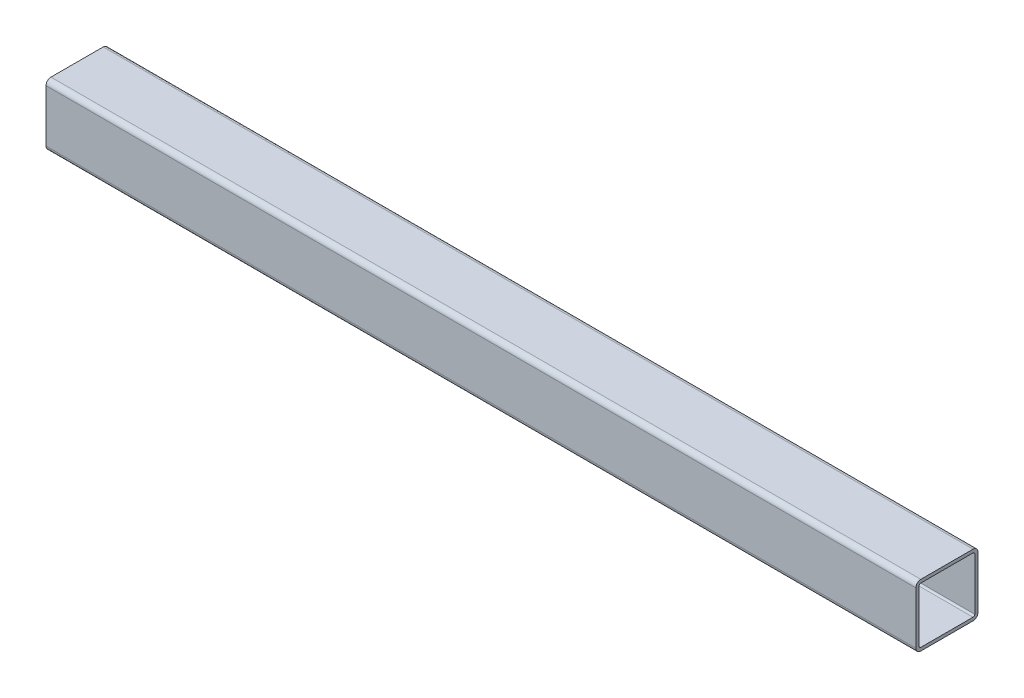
SolidWorks part; units mm, degrees
ref_plane "Front Plane" through (0, 0, 0) normal (0, 0, 1) x (1, 0, 0)
ref_plane "Top Plane" through (0, 0, 0) normal (0, 1, 0) x (1, 0, 0)
ref_plane "Right Plane" through (0, 0, 0) normal (1, 0, 0) x (0, 0, -1)
sketch "Sketch1" plane through (0, 0, 0) normal (1, 0, 0) x (0, 0, -1)
  line L0 (0, 2.54) -> (0, 29.21)
  line L1 (-2.54, 31.75) -> (-29.21, 31.75)
  line L2 (-31.75, 29.21) -> (-31.75, 2.54)
  line L3 (-29.21, 0) -> (-2.54, 0)
  line L4 (-1.651, 2.54) -> (-1.651, 29.21)
  line L5 (-2.54, 30.099) -> (-29.21, 30.099)
  line L6 (-30.099, 29.21) -> (-30.099, 2.54)
  line L7 (-29.21, 1.651) -> (-2.54, 1.651)
  arc A0 (-31.75, 2.54) -> (-29.21, 0) centre (-29.21, 2.54) ccw
  arc A1 (0, 2.54) -> (-2.54, 0) centre (-2.54, 2.54) cw
  arc A2 (0, 29.21) -> (-2.54, 31.75) centre (-2.54, 29.21) ccw
  arc A3 (-31.75, 29.21) -> (-29.21, 31.75) centre (-29.21, 29.21) cw
  arc A4 (-1.651, 29.21) -> (-2.54, 30.099) centre (-2.54, 29.21) ccw
  arc A5 (-30.099, 29.21) -> (-29.21, 30.099) centre (-29.21, 29.21) cw
  arc A6 (-30.099, 2.54) -> (-29.21, 1.651) centre (-29.21, 2.54) ccw
  arc A7 (-1.651, 2.54) -> (-2.54, 1.651) centre (-2.54, 2.54) cw
  point P12 (0, 0)
  point P15 (0, 31.75)
  point P18 (-31.75, 31.75)
  dimension "D3" = 2.54
  dimension "D1" = 31.75
  dimension "D2" = 31.75
  dimension "D4" = 1.651
extrude "Boss-Extrude1" add sketch "Sketch1" along normal blind 177.8
scale "Scale1" scale about centroid uniform scaling no x scale factor 1 y scale factor 0.4 z scale factor 0.4
